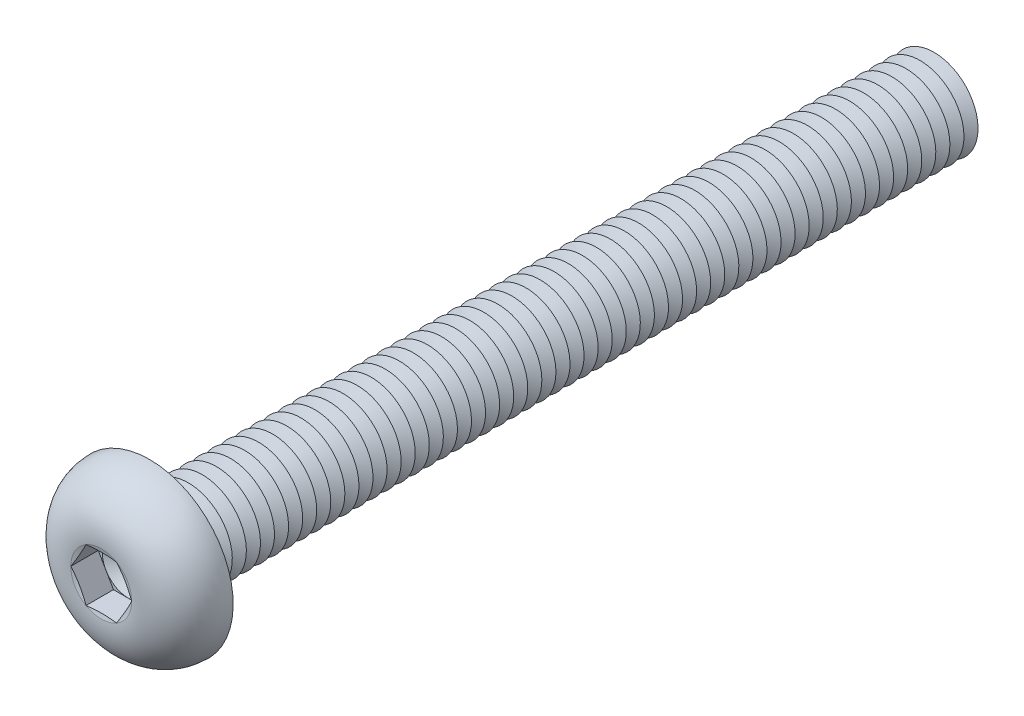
SolidWorks part; units mm, degrees
ref_plane "Front Plane" through (0, 0, 0) normal (0, 0, 1) x (1, 0, 0)
ref_plane "Top Plane" through (0, 0, 0) normal (0, 1, 0) x (1, 0, 0)
ref_plane "Right Plane" through (0, 0, 0) normal (1, 0, 0) x (0, 0, -1)
sketch "Sketch1" plane through (0, 0, 0) normal (1, 0, 0) x (0, 0, -1)
  line L0 (0, 2.5) -> (0, 4.75)
  line L3 (0, 2.5) -> (45, 2.5)
  line L4 (45, 2.5) -> (45, 0)
  line L5 (45, 0) -> (-2.75, 0) construction
  line L6 (-2.75, 0) -> (45, 0)
  line L7 (-2.75, 1.732) -> (-2.75, 0.866) construction
  line L8 (-2.75, 0.866) -> (-2.75, 0)
  line L9 (-2.75, 1.732) -> (-2.5179, 0.866)
  line L10 (-2.5179, 0.866) -> (-2.75, 0.866)
  line L11 (45, 0) -> (22.7481, 0) construction
  line L12 (0, 4.75) -> (-2.75, 4.75) construction
  arc A1 (0, 4.75) -> (-2.75, 1.732) centre (0, 1.9881) ccw
  point P8 (45, 1.25)
  dimension "D1" = 9.5
  dimension "D2" = 5
  dimension "D3" = 2.75
  dimension "D4" = 3.4641
  dimension "D5" = 45
  dimension "D6" = 15
revolve "Revolve1" add sketch "Sketch1" angle 360 about L5
fillet "Fillet1" radius 0.4 1 edges at (0, 2.5, 0)
sketch "Sketch2" plane through (0, 0, 0) normal (1, 0, 0) x (0, 0, -1)
  line L0 (44.6, 2.5) -> (45.4, 2.5)
  line L1 (45, 2.5) -> (0.4, 2.5) construction
  line L2 (45.4, 2.5) -> (45, 1.8072)
  line L3 (45, -2.5) -> (45, 2.5) construction
  line L4 (45, 1.8072) -> (44.6, 2.5)
  dimension "D1" = 0.8
revolve "Cut-Revolve1" cut sketch "Sketch2" angle 360 about axis through (0, 0, -45) along (0, 0, -1)
pattern_linear "LPattern1" count 56 spacing 0.8 along (0, 0, 1) of "Cut-Revolve1"
sketch "Sketch3" plane through (0, 0, 2.75) normal (0, 0, 1) x (1, 0, 0)
  line L7 (0.866, 1.5) -> (-0.866, 1.5)
  line L8 (-0.866, 1.5) -> (-1.7321, 0)
  line L9 (-1.7321, 0) -> (-0.866, -1.5)
  line L10 (-0.866, -1.5) -> (0.866, -1.5)
  line L11 (0.866, -1.5) -> (1.7321, 0)
  line L12 (1.7321, 0) -> (0.866, 1.5)
  circle A0 centre (0, 0) radius 1.5 construction
  circle A3 centre (0, 0) radius 1.732 construction
extrude "Cut-Extrude1" cut sketch "Sketch3" against normal blind 1.56
sketch "Sketch4" plane through (0, 0, 1.19) normal (0, 0, 1) x (1, 0, 0)
  line L1 (0.866, 1.5) -> (-0.866, 1.5) construction
  circle A0 centre (0, 0) radius 1.5
extrude "Cut-Extrude2" cut sketch "Sketch4" against normal through all draft 60
